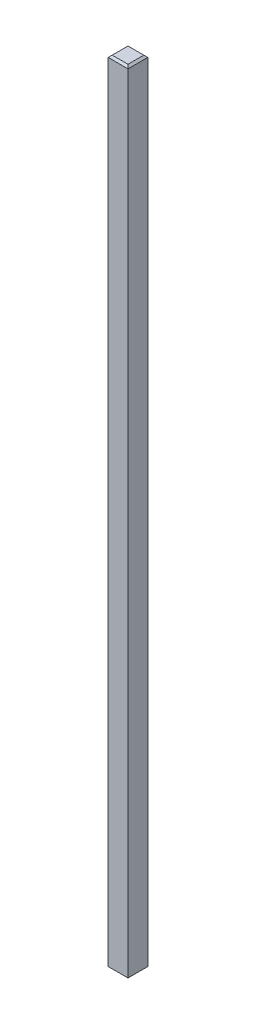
SolidWorks part; units mm, degrees
ref_plane "Plan de face" through (0, 0, 0) normal (0, 0, 1) x (1, 0, 0)
ref_plane "Plan de dessus" through (0, 0, 0) normal (0, 1, 0) x (1, 0, 0)
ref_plane "Plan de droite" through (0, 0, 0) normal (1, 0, 0) x (0, 0, -1)
sketch "Esquisse1" plane through (0, 0, 0) normal (0, 0, 1) x (1, 0, 0)
  line L1 (0, 0) -> (10, 0)
  line L2 (0, 0) -> (0, 400)
  line L3 (0, 400) -> (10, 400)
  line L4 (10, 0) -> (10, 400)
  dimension "D1" = 400
  dimension "D2" = 10
extrude "Boss.-Extru.1" add sketch "Esquisse1" along normal blind 10
chamfer "Chanfrein1" distance 1 angle 45 8 edges at (10, 400, 5) (5, 400, 10) (0, 400, 5) (5, 400, 0) (0, 0, 5) (5, 0, 10) (10, 0, 5) (5, 0, 0)
